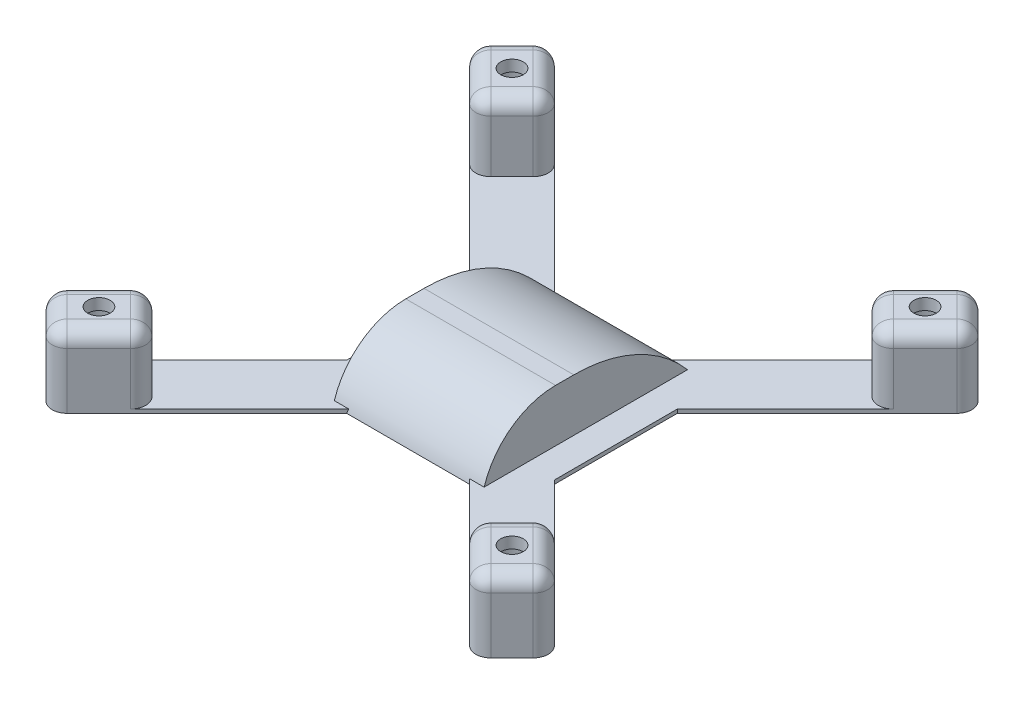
SolidWorks part; units mm, degrees
ref_plane "Alzado" through (0, 0, 0) normal (0, 0, 1) x (1, 0, 0)
ref_plane "Planta" through (0, 0, 0) normal (0, 1, 0) x (1, 0, 0)
ref_plane "Vista lateral" through (0, 0, 0) normal (1, 0, 0) x (0, 0, -1)
sketch "Croquis1" plane through (0, 0, 0) normal (0, 1, 0) x (1, 0, 0)
  line L0 (0, 0) -> (0, 8.2081)
  line L1 (28.2843, -33.9411) -> (33.9411, -28.2843)
  line L2 (0, 0) -> (6.414, 0)
  line L3 (-33.9411, 28.2843) -> (-28.2843, 33.9411)
  line L4 (-33.9411, -28.2843) -> (-13.865, -8.2081)
  line L5 (-13.865, -8.2081) -> (-13.865, 8.2081)
  line L6 (-33.9411, 28.2843) -> (-13.865, 8.2081)
  line L7 (28.2843, -33.9411) -> (8.2081, -13.865)
  line L8 (8.2081, -13.865) -> (-8.2081, -13.865)
  line L9 (-28.2843, -33.9411) -> (-8.2081, -13.865)
  line L13 (-33.9411, -28.2843) -> (-28.2843, -33.9411)
  line L15 (28.2843, 33.9411) -> (33.9411, 28.2843)
  line L22 (-28.2843, 33.9411) -> (-8.2081, 13.865)
  line L23 (28.2843, 33.9411) -> (8.2081, 13.865)
  line L24 (8.2081, 13.865) -> (-8.2081, 13.865)
  line L25 (33.9411, 28.2843) -> (13.865, 8.2081)
  line L26 (33.9411, -28.2843) -> (13.865, -8.2081)
  line L27 (13.865, -8.2081) -> (13.865, 8.2081)
  circle A0 centre (-27.5772, 27.5772) radius 3
  circle A2 centre (27.5772, -27.5772) radius 3
  circle A3 centre (-27.5772, -27.5772) radius 3
  circle A4 centre (27.5772, 27.5772) radius 3
  point P0 (0, 0)
  point P6 (-13.865, 13.865)
  point P18 (0, 0)
  point P38 (13.865, 13.865)
  point P39 (13.865, -13.865)
  point P40 (-13.865, -13.865)
extrude "Saliente-Extruir1" add sketch "Croquis1" along normal blind 0.5 contours L6 L5 L4 L13 L9 L8 L7 L1 L26 L27 L25 L15 L23 L24 L22 L3
sketch "Croquis2" plane through (0, 0.5, 0) normal (0, 1, 0) x (1, 0, 0)
  line L0 (31.1127, 31.1127) -> (27.5772, 27.5772)
  line L1 (28.2843, 33.9411) -> (33.9411, 28.2843) construction
  line L2 (0, 0) -> (0, 6.7235)
  line L3 (26.8701, 21.2132) -> (33.9411, 28.2843)
  line L4 (26.8701, 21.2132) -> (21.2132, 26.8701)
  line L5 (21.2132, 26.8701) -> (28.2843, 33.9411)
  line L6 (33.9411, 28.2843) -> (28.2843, 33.9411)
  line L7 (26.8701, 21.2132) -> (28.2843, 33.9411) construction
  line L8 (21.2132, 26.8701) -> (33.9411, 28.2843) construction
  line L9 (0, 0) -> (5.2498, 0)
  line L10 (21.2132, -26.8701) -> (33.9411, -28.2843) construction
  line L11 (26.8701, -21.2132) -> (28.2843, -33.9411) construction
  line L12 (33.9411, -28.2843) -> (28.2843, -33.9411)
  line L13 (21.2132, -26.8701) -> (28.2843, -33.9411)
  line L14 (26.8701, -21.2132) -> (21.2132, -26.8701)
  line L15 (26.8701, -21.2132) -> (33.9411, -28.2843)
  line L16 (-21.2132, 26.8701) -> (-33.9411, 28.2843) construction
  line L17 (-26.8701, 21.2132) -> (-28.2843, 33.9411) construction
  line L18 (-33.9411, 28.2843) -> (-28.2843, 33.9411)
  line L19 (-26.8701, 21.2132) -> (-21.2132, 26.8701)
  line L20 (-26.8701, 21.2132) -> (-33.9411, 28.2843)
  line L21 (-21.2132, 26.8701) -> (-28.2843, 33.9411)
  line L22 (-26.8701, -21.2132) -> (-28.2843, -33.9411) construction
  line L23 (-21.2132, -26.8701) -> (-33.9411, -28.2843) construction
  line L24 (-26.8701, -21.2132) -> (-33.9411, -28.2843)
  line L25 (-26.8701, -21.2132) -> (-21.2132, -26.8701)
  line L26 (-21.2132, -26.8701) -> (-28.2843, -33.9411)
  line L27 (-33.9411, -28.2843) -> (-28.2843, -33.9411)
  point P4 (27.5772, 27.5772)
  point P17 (27.5772, -27.5772)
  point P22 (-27.5772, 27.5772)
  point P27 (-27.5772, -27.5772)
extrude "Saliente-Extruir2" add sketch "Croquis2" along normal blind 9
sketch "Croquis3" plane through (0, 0.5, 0) normal (0, 1, 0) x (1, 0, 0)
  line L1 (10, 13.865) -> (-10, 13.865)
  line L2 (10, 13.865) -> (10, -13.865)
  line L3 (10, -13.865) -> (-10, -13.865)
  line L4 (-10, 13.865) -> (-10, -13.865)
  line L5 (10, 13.865) -> (-10, -13.865) construction
  line L6 (10, -13.865) -> (-10, 13.865) construction
  point P0 (0, 0)
extrude "Saliente-Extruir3" add sketch "Croquis3" along normal blind 7
fillet "Redondeo1" radius 10 1 edges at (0, 7.5, 13.865)
fillet "Redondeo2" radius 20 1 edges at (0, 7.5, -13.865)
fillet "Redondeo4" radius 2 32 edges at (-24.0416, 9.5, 24.0416) (-24.7487, 9.5, 30.4056) (-31.1127, 9.5, 31.1127) (-30.4056, 9.5, 24.7487) (-26.8701, 5, 21.2132) (-21.2132, 5, 26.8701) (-28.2843, 4.75, 33.9411) (-33.9411, 4.75, 28.2843) (-24.0416, 9.5, -24.0416) (-30.4056, 9.5, -24.7487) (-24.7487, 9.5, -30.4056) (-31.1127, 9.5, -31.1127) (-33.9411, 4.75, -28.2843) (-28.2843, 4.75, -33.9411) (26.8701, 5, -21.2132) (30.4056, 9.5, -24.7487) (24.0416, 9.5, -24.0416) (24.7487, 9.5, -30.4056) (21.2132, 5, -26.8701) (31.1127, 9.5, -31.1127) (28.2843, 4.75, -33.9411) (33.9411, 4.75, -28.2843) (30.4056, 9.5, 24.7487) (24.0416, 9.5, 24.0416) (24.7487, 9.5, 30.4056) (31.1127, 9.5, 31.1127) (28.2843, 4.75, 33.9411) (33.9411, 4.75, 28.2843) (21.2132, 5, 26.8701) (26.8701, 5, 21.2132)
sketch "Croquis7" plane through (0, 0, 0) normal (0, -1, 0) x (1, 0, 0)
  line L0 (-31.1127, 31.1127) -> (-27.5772, 27.5772)
  line L1 (-32.5269, 29.6985) -> (-29.6985, 32.5269) construction
  line L2 (0, 0) -> (-7.4579, 0)
  line L3 (0, 0) -> (0, 7.0985)
  circle A0 centre (-27.5772, 27.5772) radius 3.05
  circle A1 centre (27.5772, 27.5772) radius 3.05
  circle A2 centre (27.5772, -27.5772) radius 3.05
  circle A3 centre (-27.5772, -27.5772) radius 3.05
extrude "Cortar-Extruir4" cut sketch "Croquis7" against normal blind 8
sketch "Croquis8" plane through (0, 8, 0) normal (0, -1, 0) x (1, 0, 0)
  line L0 (0, 0) -> (0, 6.5594)
  line L1 (0, 0) -> (6.5594, 0)
  circle A0 centre (27.5772, 27.5772) radius 1.5
  circle A1 centre (27.5772, -27.5772) radius 1.5
  circle A2 centre (-27.5772, -27.5772) radius 1.5
  circle A3 centre (-27.5772, 27.5772) radius 1.5
extrude "Cortar-Extruir5" cut sketch "Croquis8" against normal blind 8 contours A3 | A0 | A1 | A2
